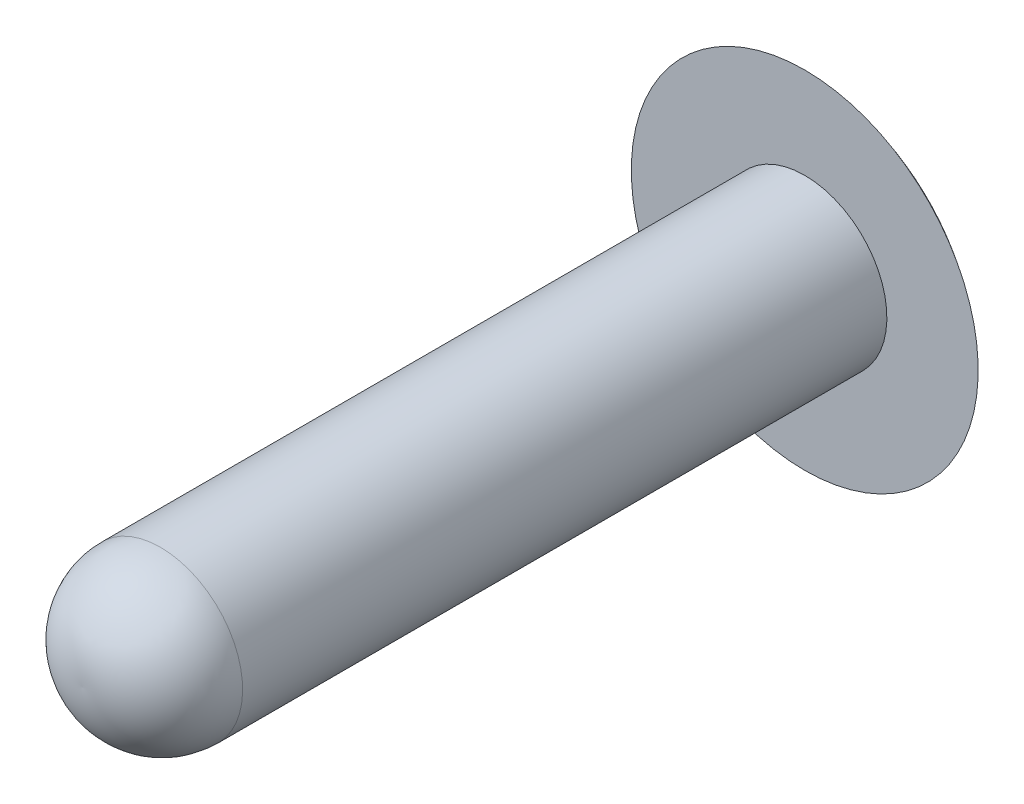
SolidWorks part; units mm, degrees
ref_plane "Alzado" through (0, 0, 0) normal (0, 0, 1) x (1, 0, 0)
ref_plane "Planta" through (0, 0, 0) normal (0, 1, 0) x (1, 0, 0)
ref_plane "Vista lateral" through (0, 0, 0) normal (1, 0, 0) x (0, 0, -1)
sketch "Croquis2" plane through (0, 0, 0) normal (1, 0, 0) x (0, 0, -1)
  line L0 (-7.3974, -10.0284) -> (17.3064, -10.0284)
  line L1 (17.3064, -10.0284) -> (17.3064, -13.5284)
  line L2 (19.6064, -6.8784) -> (-10.3936, -6.8784)
  arc A0 (-7.3974, -10.0284) -> (-10.3936, -6.8784) centre (-7.3974, -7.0284) cw
  arc A1 (19.6064, -6.8784) -> (17.3064, -13.5284) centre (8.8428, -6.8784) cw
  dimension "D5" = 3
  dimension "D1" = 2.3
  dimension "D2" = 6.65
  dimension "D3" = 3.15
  dimension "D4" = 30
revolve "Revolución2" add sketch "Croquis2" angle 360 about L2
